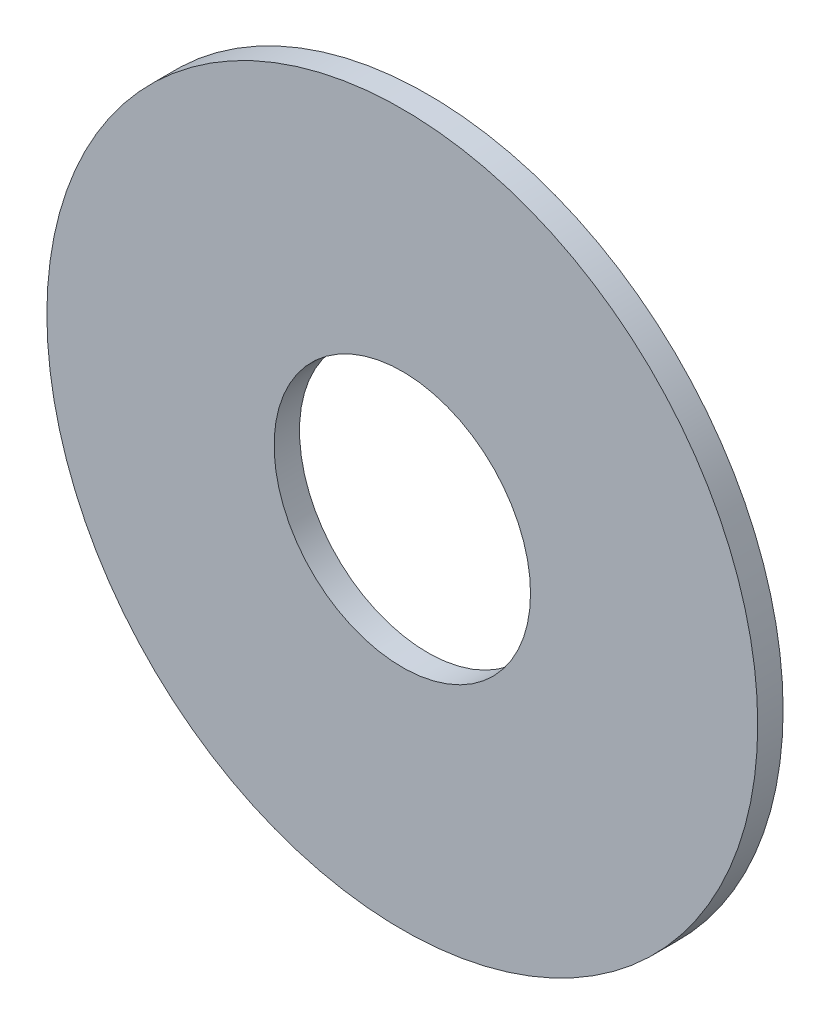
SolidWorks part; units mm, degrees
ref_plane "Face" through (0, 0, 0) normal (0, 0, 1) x (1, 0, 0)
ref_plane "Dessus" through (0, 0, 0) normal (0, 1, 0) x (1, 0, 0)
ref_plane "Droite" through (0, 0, 0) normal (1, 0, 0) x (0, 0, -1)
sketch "Esquisse1" plane through (0, 0, 0) normal (0, 0, 1) x (1, 0, 0)
  circle A0 centre (0, 29) radius 14
  circle A1 centre (0, 29) radius 5 construction
  circle A2 centre (0, 29) radius 5.05
  dimension "D1" = 28
  dimension "D2" = 10.1
extrude "Extrusion1" add sketch "Esquisse1" along normal blind 1
